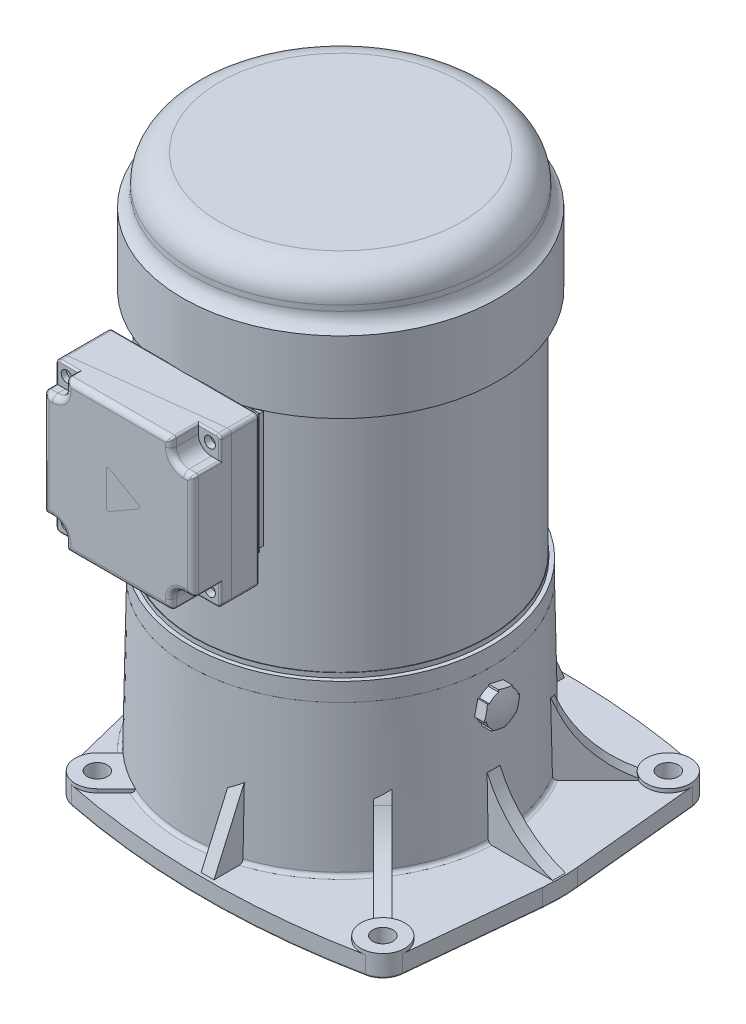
SolidWorks part; units mm, degrees
ref_plane "前视基准面" through (0, 0, 0) normal (0, 0, 1) x (1, 0, 0)
ref_plane "上视基准面" through (0, 0, 0) normal (0, 1, 0) x (1, 0, 0)
ref_plane "右视基准面" through (0, 0, 0) normal (1, 0, 0) x (0, 0, -1)
imported_body "接线盒座-1-surface1"
imported_body "接线盒座-1-surface2"
imported_body "接线盒座-1-surface3"
imported_body "接线盒座-1-surface4"
imported_body "接线盒座-1-surface5"
imported_body "接线盒座-1-surface6"
imported_body "接线盒盖-1-surface1"
imported_body "接线盒盖-1-surface2"
imported_body "接线盒盖-1-surface3"
imported_body "接线盒盖-1-surface4"
imported_body "立式箱体装配体1-1/28A立式箱体-1-surface1"
imported_body "立式箱体装配体1-1/28输出轴-1-surface1"
imported_body "立式箱体装配体1-1/28输出轴-1-surface2"
imported_body "立式箱体装配体1-1/16.04.20 28箱盖配B版电机1500-1-surface1"
imported_body "立式箱体装配体1-1/16.04.20 28箱盖配B版电机1500-1-surface2"
imported_body "立式箱体装配体1-1/16.04.20 28箱盖配B版电机1500-1-surface3"
imported_body "立式箱体装配体1-1/16.04.20 28箱盖配B版电机1500-1-surface4"
imported_body "立式箱体装配体1-1/GB／T13871．1-2007唇形密封圈B型B15 30X45X7-1-surface1"
imported_body "立式箱体装配体1-1/7X40-1-surface1"
imported_body "立式箱体装配体1-1/透气塞-1-surface1"
sketch "草图1" plane through (0, -132.4464, 0) normal (0, 1, 0) x (1, 0, 0)
  circle A0 centre (71.682, -8.1073) radius 80
extrude "凸台-拉伸1" add sketch "草图1" along normal blind 124
sketch "草图2" plane through (0, -8.4464, 0) normal (0, 1, 0) x (1, 0, 0)
  circle A0 centre (71.682, -8.1073) radius 86
extrude "凸台-拉伸2" add sketch "草图2" along normal blind 39
sketch "草图3" plane through (0, 30.5536, 0) normal (0, 1, 0) x (1, 0, 0)
  circle A0 centre (71.682, -8.1073) radius 81
extrude "凸台-拉伸3" add sketch "草图3" along normal blind 26
fillet "圆角1" radius 15 1 edges at (71.682, 56.5536, 89.1073)
fillet "圆角2" radius 9 1 edges at (71.682, 30.5536, 89.1073)
